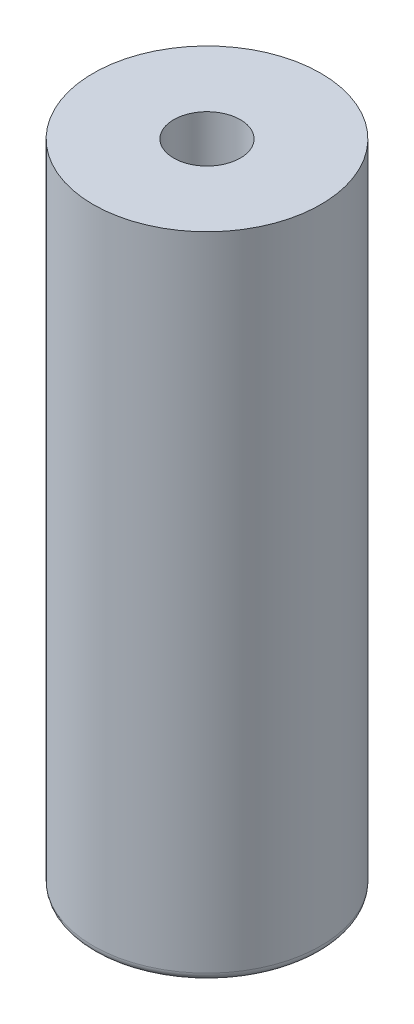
SolidWorks part; units mm, degrees
ref_plane "前视基准面" through (0, 0, 0) normal (0, 0, 1) x (1, 0, 0)
ref_plane "上视基准面" through (0, 0, 0) normal (0, 1, 0) x (1, 0, 0)
ref_plane "右视基准面" through (0, 0, 0) normal (1, 0, 0) x (0, 0, -1)
other "Configuration Table"
sketch "草图1" plane through (0, 0, 0) normal (0, 0, 1) x (1, 0, 0)
  line L0 (0, 0) -> (0, 8.6223) construction
  line L1 (-7, 0) -> (-2.05, 0)
  line L2 (-2.05, 0) -> (-2.05, -4)
  line L3 (-2.05, -4) -> (-3.8, -4)
  line L4 (-3.8, -4) -> (-3.8, -40)
  line L5 (-3.8, -40) -> (-7, -40)
  line L6 (-7, -40) -> (-7, 0)
  dimension "D1" = 7
  dimension "D2" = 2.05
  dimension "D3" = 3.8
  dimension "D4" = 7
  dimension "D5" = 36
  dimension "D6" = 40
revolve "旋转1" add sketch "草图1" angle 360 about L0
fillet "圆角1" radius 0.5 2 edges at (0, -40, -3.8) (0, -40, -7)
